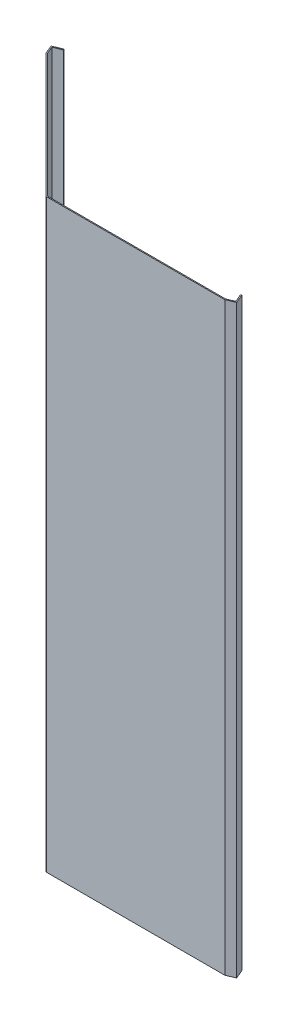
SolidWorks part; units mm, degrees
ref_plane "Plan de face" through (0, 0, 0) normal (0, 0, 1) x (1, 0, 0)
ref_plane "Plan de dessus" through (0, 0, 0) normal (0, 1, 0) x (1, 0, 0)
ref_plane "Plan de droite" through (0, 0, 0) normal (1, 0, 0) x (0, 0, -1)
sketch "Esquisse1" plane through (0, 0, 0) normal (0, 1, 0) x (1, 0, 0)
  line L0 (0, 0) -> (-695, 0)
  line L1 (-695, 0) -> (-1179.3681, 484.3681)
  line L2 (0, 0) -> (32.2177, 13.6756)
  line L3 (32.2177, 13.6756) -> (17.3699, 48.6548)
  line L4 (-1179.3681, 484.3681) -> (-1192.4794, 516.8196)
  line L5 (-1192.4794, 516.8196) -> (-1157.2464, 531.0546)
  dimension "D1" = 695
  dimension "D2" = 685
  dimension "D3" = 135
  dimension "D4" = 35
  dimension "D5" = 38
  dimension "D6" = 23
  dimension "D7" = 35
  dimension "D8" = 38
  dimension "D9" = 23
extrude "Extru.-Mince1" add sketch "Esquisse1" along normal blind 2276 thin
fillet "Congé1" radius 4 1 edges at (-695, 1138, 0)
fillet "Congé2" radius 2 1 edges at (-693.3431, 1138, -4)
sketch "Esquisse2" plane through (-347.5, 0, 347.5) normal (-0.7071, 0, 0.7071) x (0.7071, 0, 0.7071)
  line L1 (-1061.6569, 1480) -> (-611.6569, 1480)
  line L2 (-1061.6569, 1480) -> (-1061.6569, 1420)
  line L3 (-1061.6569, 1420) -> (-611.6569, 1420)
  line L4 (-611.6569, 1480) -> (-611.6569, 1420)
  line L5 (-1001.6569, 665) -> (-571.6569, 665)
  line L6 (-1001.6569, 665) -> (-1001.6569, -60.0162)
  line L7 (-1001.6569, -60.0162) -> (-571.6569, -60.0162)
  line L8 (-571.6569, 665) -> (-571.6569, -60.0162)
  line L9 (-1208.6569, 2276) -> (-1208.6569, 0) construction
  line L10 (-493.0961, 0) -> (-1176.4392, 0) construction
  line L11 (-1061.6569, 1560) -> (-611.6569, 1560)
  line L12 (-1061.6569, 1560) -> (-1061.6569, 1500)
  line L13 (-1061.6569, 1500) -> (-611.6569, 1500)
  line L14 (-611.6569, 1560) -> (-611.6569, 1500)
  line L15 (-1061.6569, 1640) -> (-611.6569, 1640)
  line L16 (-1061.6569, 1640) -> (-1061.6569, 1580)
  line L17 (-1061.6569, 1580) -> (-611.6569, 1580)
  line L18 (-611.6569, 1640) -> (-611.6569, 1580)
  line L19 (-1061.6569, 1720) -> (-611.6569, 1720)
  line L20 (-1061.6569, 1720) -> (-1061.6569, 1660)
  line L21 (-1061.6569, 1660) -> (-611.6569, 1660)
  line L22 (-611.6569, 1720) -> (-611.6569, 1660)
  line L23 (-1061.6569, 1800) -> (-611.6569, 1800)
  line L24 (-1061.6569, 1800) -> (-1061.6569, 1740)
  line L25 (-1061.6569, 1740) -> (-611.6569, 1740)
  line L26 (-611.6569, 1800) -> (-611.6569, 1740)
  dimension "D1" = 207
  dimension "D2" = 430
  dimension "D3" = 665
  dimension "D4" = 1420
  dimension "D5" = 60
  dimension "D6" = 147
  dimension "D7" = 450
  dimension "D8" = 5
extrude "Enlèv. mat.-Extru.1" cut sketch "Esquisse2" against normal through all
